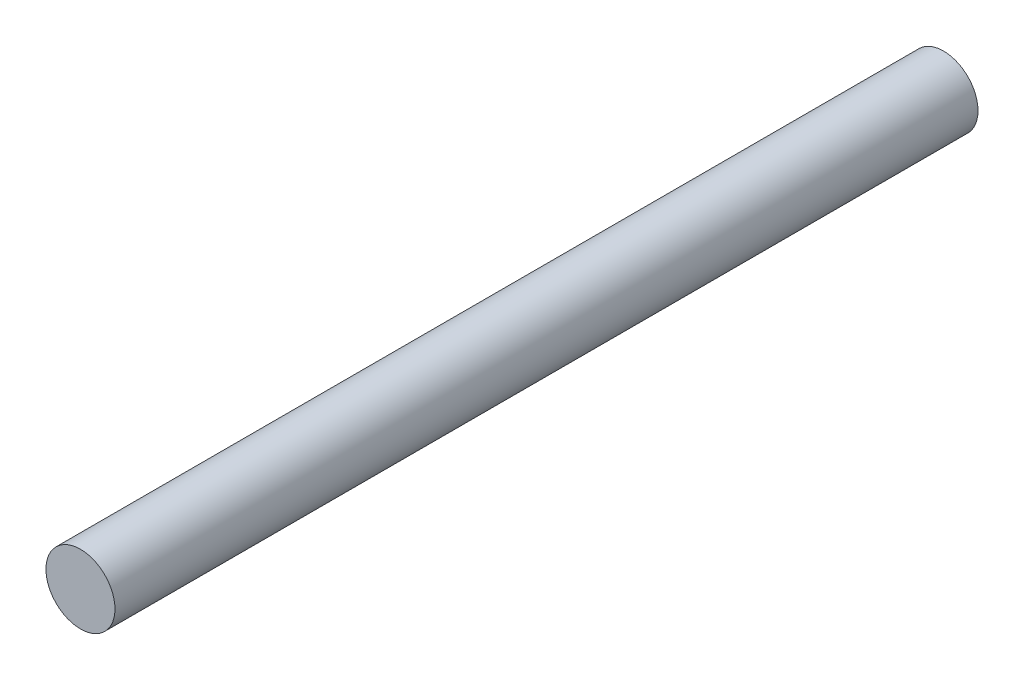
SolidWorks part; units mm, degrees
ref_plane "Front" through (0, 0, 0) normal (0, 0, 1) x (1, 0, 0)
ref_plane "Top" through (0, 0, 0) normal (0, 1, 0) x (1, 0, 0)
ref_plane "Right" through (0, 0, 0) normal (1, 0, 0) x (0, 0, -1)
sketch "Sketch2" plane through (0, 0, 0) normal (0, 0, 1) x (1, 0, 0)
  circle A0 centre (0, 0) radius 50.8
extrude "Base-Extrude" add sketch "Sketch2" against normal blind 1270
